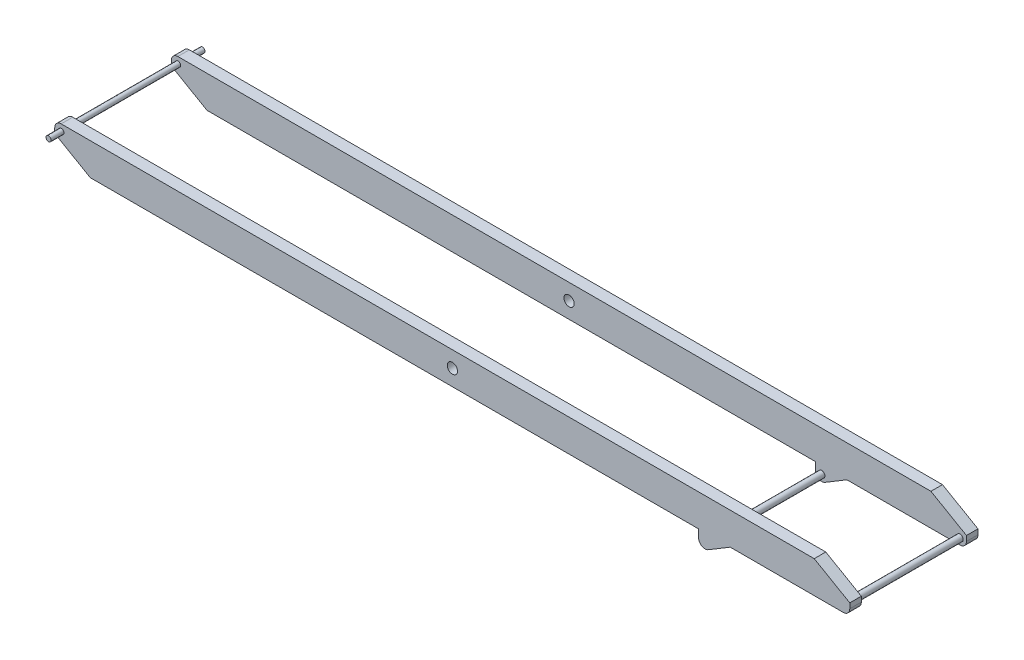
SolidWorks part; units mm, degrees
ref_plane "Face" through (0, 0, 0) normal (0, 0, 1) x (1, 0, 0)
ref_plane "Dessus" through (0, 0, 0) normal (0, 1, 0) x (1, 0, 0)
ref_plane "Droite" through (0, 0, 0) normal (1, 0, 0) x (0, 0, -1)
sketch "Esquisse1" plane through (0, 0, 0) normal (0, 0, 1) x (1, 0, 0)
  line L0 (50, 0) -> (50, 40)
  line L1 (-227.1281, 200) -> (-6100, 200)
  line L2 (-6150, 110) -> (-5872.8719, -50)
  line L3 (0, -50) -> (-5872.8719, -50)
  line L4 (-6150, 150) -> (-6150, 110)
  line L5 (50, 40) -> (-227.1281, 200)
  circle A0 centre (0, 0) radius 25
  arc A1 (0, -50) -> (50, 0) centre (0, 0) ccw
  circle A2 centre (-6098.1555, 150) radius 20
  arc A3 (-6100, 200) -> (-6150, 150) centre (-6100, 150) ccw
  dimension "D1" = 50
  dimension "D2" = 200
  dimension "D4" = 40
  dimension "D8" = 50
  dimension "D3" = 6150
  dimension "D5" = 6100
  dimension "D6" = 250
  dimension "D7" = 50
  dimension "D9" = 30
  dimension "D10" = 40
  dimension "D11" = 30
  dimension "D12" = 40
extrude "Extrusion1" add sketch "Esquisse1" along normal mid plane 1000
sketch "Esquisse2" plane through (0, 200, 0) normal (0, 1, 0) x (1, 0, 0)
  line L0 (-227.1281, 500) -> (-6100, 500) construction
  line L1 (-6402.7566, 410) -> (211.9968, 410)
  line L2 (-6402.7566, 410) -> (-6402.7566, -410)
  line L3 (-6402.7566, -410) -> (211.9968, -410)
  line L4 (211.9968, 410) -> (211.9968, -410)
  dimension "D1" = 820
  dimension "D2" = 90
extrude "Enlèv. mat.-Extru.1" cut sketch "Esquisse2" against normal through all
sketch "Esquisse3" plane through (0, 0, 0) normal (0, 0, 1) x (1, 0, 0)
  circle A0 centre (-6098.1555, 150) radius 20
  circle A1 centre (-6098.1555, 150) radius 20 construction
extrude "Extrusion2" add sketch "Esquisse3" along normal mid plane 1200
sketch "Esquisse4" plane through (0, 0, 0) normal (0, 0, 1) x (1, 0, 0)
  circle A0 centre (0, 0) radius 25 construction
  circle A1 centre (0, 0) radius 25
extrude "Extrusion3" add sketch "Esquisse4" along normal mid plane 1000
sketch "Esquisse5" plane through (0, 0, 0) normal (0, 0, 1) x (1, 0, 0)
  line L1 (-227.1281, 200) -> (-6100, 200) construction
  circle A0 centre (-3049.0777, 75) radius 40
  dimension "D1" = 80
  dimension "D2" = 3050
  dimension "D3" = 125
sketch "Esquisse7" plane through (0, 0, 0) normal (0, 0, 1) x (1, 0, 0)
  line L0 (-5872.8719, -50) -> (0, -50) construction
  circle A0 centre (-1078.917, -110) radius 25
  dimension "D3" = 50
  dimension "D1" = 1084.51
  dimension "D2" = 60
extrude "Extrusion4" add sketch "Esquisse7" along normal mid plane 1000
sketch "Esquisse8" plane through (0, 0, 500) normal (0, 0, 1) x (1, 0, 0)
  line L0 (-1128.917, -110) -> (-1128.917, -23.1021)
  line L1 (-1128.917, -23.1021) -> (-837.1782, -23.1021)
  line L2 (-837.1782, -23.1021) -> (-1053.1683, -152.8603)
  arc A0 (-1128.917, -110) -> (-1053.1683, -152.8603) centre (-1078.917, -110) ccw
  dimension "D1" = 100
extrude "Extrusion5" add sketch "Esquisse8" against normal up to surface (90 mm away)
sketch "Esquisse9" plane through (0, 0, -500) normal (0, 0, -1) x (-1, 0, 0)
  line L9 (0, -50) -> (881.9513, -50)
  line L10 (881.9513, -50) -> (1053.1683, -152.8603)
  line L11 (1128.917, -110) -> (1128.917, -50)
  line L12 (1128.917, -50) -> (5872.8719, -50)
  line L13 (5872.8719, -50) -> (6150, 110)
  line L14 (6150, 110) -> (6150, 150)
  line L15 (6100, 200) -> (227.1281, 200)
  line L16 (227.1281, 200) -> (-50, 40)
  line L17 (-50, 40) -> (-50, 0)
  line L18 (0, -50) -> (881.9513, -50)
  line L19 (881.9513, -50) -> (1053.1683, -152.8603)
  line L20 (1128.917, -110) -> (1128.917, -50)
  line L21 (1128.917, -50) -> (5872.8719, -50)
  line L22 (5872.8719, -50) -> (6150, 110)
  line L23 (6150, 110) -> (6150, 150)
  line L24 (6100, 200) -> (227.1281, 200)
  line L25 (227.1281, 200) -> (-50, 40)
  line L26 (-50, 40) -> (-50, 0)
  arc A3 (1053.1683, -152.8603) -> (1128.917, -110) centre (1078.917, -110) ccw
  arc A4 (6150, 150) -> (6100, 200) centre (6100, 150) ccw
  arc A5 (-50, 0) -> (0, -50) centre (0, 0) ccw
  arc A6 (1053.1683, -152.8603) -> (1128.917, -110) centre (1078.917, -110) ccw
  arc A7 (6150, 150) -> (6100, 200) centre (6100, 150) ccw
  arc A8 (-50, 0) -> (0, -50) centre (0, 0) ccw
  dimension "D1" = 0
extrude "Extrusion6" add sketch "Esquisse9" against normal up to surface (90 mm away)
extrude "Enlèv. mat.-Extru.3" cut sketch "Esquisse5" against normal through all and the other way through all
